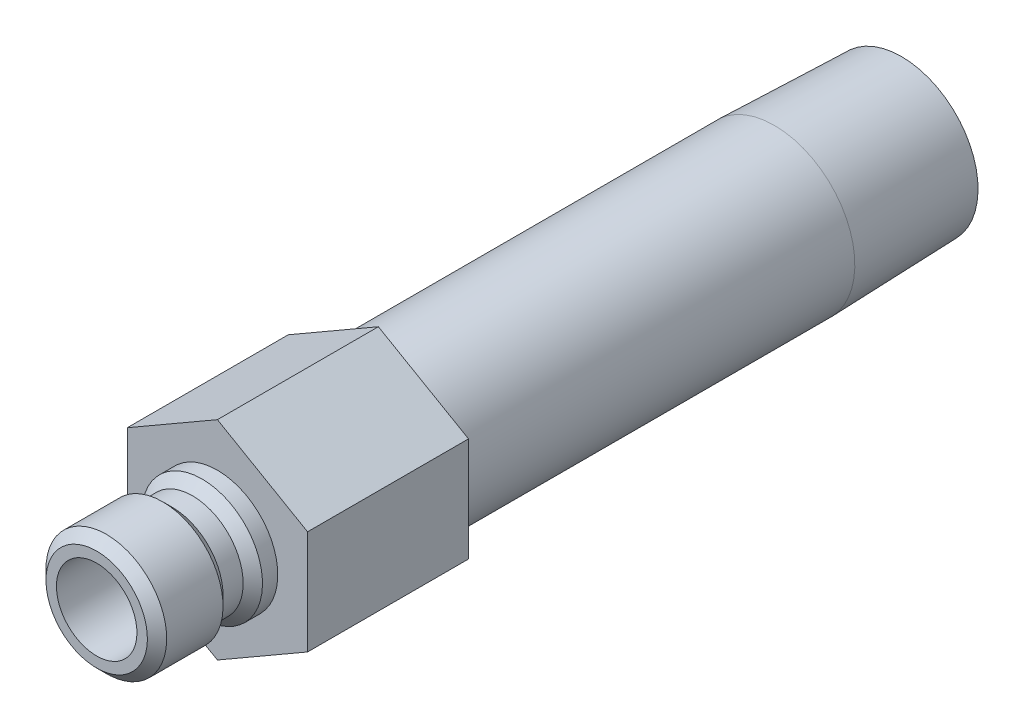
SolidWorks part; units mm, degrees
ref_plane "Front Plane" through (0, 0, 0) normal (0, 0, 1) x (1, 0, 0)
ref_plane "Top Plane" through (0, 0, 0) normal (0, 1, 0) x (1, 0, 0)
ref_plane "Right Plane" through (0, 0, 0) normal (1, 0, 0) x (0, 0, -1)
sketch "Sketch1" plane through (0, 0, 0) normal (1, 0, 0) x (0, 0, -1)
  line L0 (0, 0) -> (-12.7, 0) construction
  line L1 (-9.525, 3.175) -> (-9.525, 4.0005)
  line L2 (-3.556, 4.0005) -> (-3.556, 0) construction
  line L3 (-8.763, 4.7625) -> (-4.318, 4.7625)
  line L4 (0, 6.35) -> (0, 0) construction
  line L5 (-3.556, 4.0005) -> (-1.9685, 4.0005)
  line L6 (-1.2065, 4.7625) -> (0, 4.7625)
  line L7 (0, 4.7625) -> (0, 6.35)
  line L8 (-3.556, 4.0005) -> (-4.318, 4.7625)
  line L9 (-1.9685, 4.0005) -> (-1.2065, 4.7625)
  line L10 (-9.525, 4.0005) -> (-8.763, 4.7625)
  line L11 (12.7, 4.6228) -> (53.975, 4.6228)
  line L12 (0, 6.35) -> (43.942, 6.35)
  line L13 (43.942, 6.35) -> (53.975, 6.0365)
  line L14 (53.975, 6.0365) -> (53.975, 4.6228)
  line L15 (0, 0) -> (12.7, 0) construction
  line L16 (12.7, 0) -> (12.7, 4.7625) construction
  line L17 (12.7, 4.7625) -> (0, 4.7625) construction
  line L18 (12.7, 4.6228) -> (12.7, 3.175)
  line L19 (12.7, 3.175) -> (-9.525, 3.175)
  dimension "D1" = 9.525
  dimension "D2" = 1.5875
  dimension "D3" = 0.762
  dimension "D4" = 45
  dimension "D5" = 5.969
  dimension "D6" = 45
  dimension "D7" = 1.79
  dimension "D8" = 10.033
  dimension "D9" = 63.5
  dimension "D10" = 3.175
  dimension "D11" = 22.225
  dimension "D12" = 9.2456
  dimension "D13" = 6.35
  dimension "D14" = 9.525
  dimension "D15" = 12.7
revolve "Revolve1" add sketch "Sketch1" angle 360 about L0
sketch "Sketch2" plane through (0, 0, 0) normal (0, 0, 1) x (1, 0, 0)
  line L1 (-7.112, 4.1061) -> (-7.112, -4.1061)
  line L2 (-7.112, -4.1061) -> (0, -8.2122)
  line L3 (0, -8.2122) -> (7.112, -4.1061)
  line L4 (7.112, -4.1061) -> (7.112, 4.1061)
  line L5 (7.112, 4.1061) -> (0, 8.2122)
  line L6 (0, 8.2122) -> (-7.112, 4.1061)
  circle A0 centre (0, 0) radius 7.112 construction
  circle A1 centre (0, 0) radius 3.175 construction
  circle A2 centre (0, 0) radius 3.175
  dimension "D1" = 14.224
extrude "Boss-Extrude1" add sketch "Sketch2" against normal up to vertex (12.7 mm away) from vertex at 0
